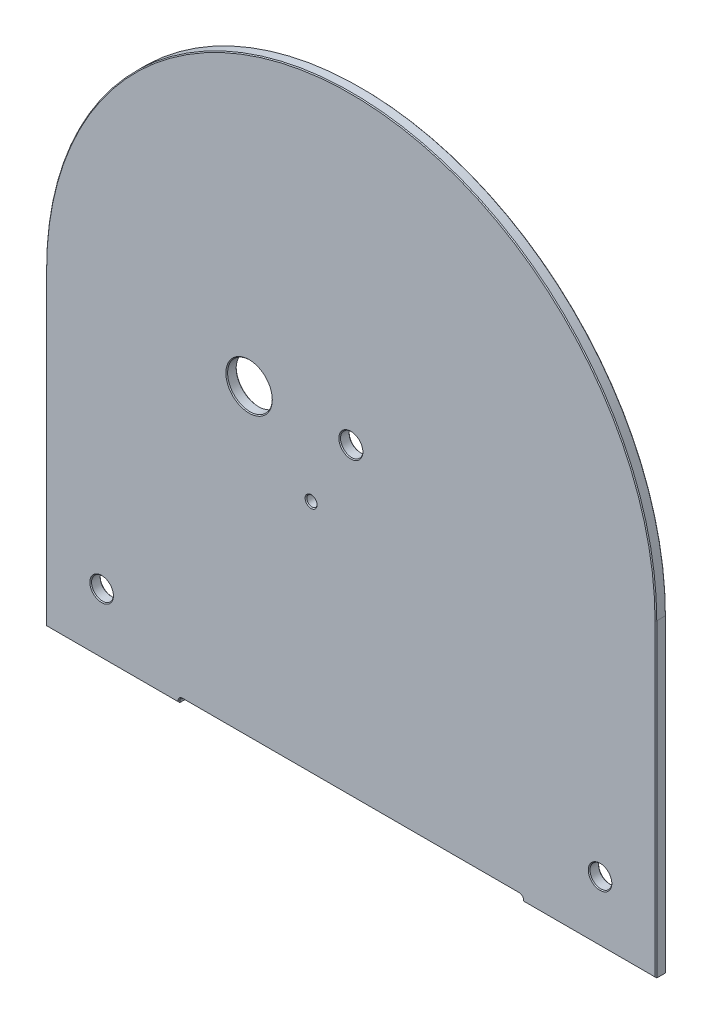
SolidWorks part; units mm, degrees
ref_plane "Спереди" through (0, 0, 0) normal (0, 0, 1) x (1, 0, 0)
ref_plane "Сверху" through (0, 0, 0) normal (0, 1, 0) x (1, 0, 0)
ref_plane "Справа" through (0, 0, 0) normal (1, 0, 0) x (0, 0, -1)
sketch "Эскиз1" plane through (0, 0, 0) normal (0, 0, 1) x (1, 0, 0)
  line L253 (138.6787, -143.73) -> (151.3214, -143.73) construction
  line L255 (-177.5, 1.27) -> (177.5, 1.27) construction
  line L534 (177.5, 1.27) -> (177.5, -178.73)
  line L535 (177.5, -178.73) -> (100, -178.73)
  line L536 (100, -178.73) -> (100, -177.73)
  line L564 (-98, -175.73) -> (98, -175.73)
  line L591 (-100, -178.73) -> (-100, -177.73)
  line L1215 (-177.5, 1.27) -> (-177.5, -178.73)
  line L1388 (-100, -178.73) -> (-177.5, -178.73)
  circle A0 centre (-145, -143.73) radius 6.35
  circle A1 centre (145, -143.73) radius 6.35
  arc A2 (-98, -175.73) -> (-100, -177.73) centre (-98, -177.73) ccw
  arc A3 (100, -177.73) -> (98, -175.73) centre (98, -177.73) ccw
  circle A4 centre (0, 1.27) radius 6.5
  arc A5 (177.5, 1.27) -> (-177.5, 1.27) centre (0, 1.27) ccw
  circle A6 centre (-59.2, 1.27) radius 13
  circle A7 centre (-23.12, -38.7288) radius 3
  circle A8 centre (0, 1.27) radius 46.2 construction
  dimension "D3" = 12.7
  dimension "D9" = 2
  dimension "D10" = 13
  dimension "D11" = 355
  dimension "D13" = 26
  dimension "D15" = 6
  dimension "D17" = 92.4
  dimension "D2" = 177.5
  dimension "D4" = 290
  dimension "D5" = 145
  dimension "D6" = 35
  dimension "D7" = 77.5
  dimension "D8" = 3
  dimension "D12" = 1.27
  dimension "D14" = 59.2
  dimension "D16" = 23.12
  dimension "D18" = 180
extrude "Бобышка-Вытянуть1" add sketch "Эскиз1" along normal blind 6
chamfer "Фаска1" distance 0.5 angle 45 30 edges at (-46.2, 1.27, 0) (6.5, 1.27, 0) (-138.65, -143.73, 0) (0, -175.73, 0) (99.4142, -176.3158, 0) (100, -178.23, 0) (138.75, -178.73, 0) (177.5, -88.73, 0) (0, 178.77, 0) (-177.5, -88.73, 0) (-138.75, -178.73, 0) (-100, -178.23, 0) (-99.4142, -176.3158, 0) (151.35, -143.73, 0) (-20.12, -38.7288, 0) (-46.2, 1.27, 6) (6.5, 1.27, 6) (-138.65, -143.73, 6) (-100, -178.23, 6) (-138.75, -178.73, 6) (-177.5, -88.73, 6) (0, 178.77, 6) (177.5, -88.73, 6) (138.75, -178.73, 6) (100, -178.23, 6) (99.4142, -176.3158, 6) (0, -175.73, 6) (-99.4142, -176.3158, 6) (151.35, -143.73, 6) (-20.12, -38.7288, 6)
